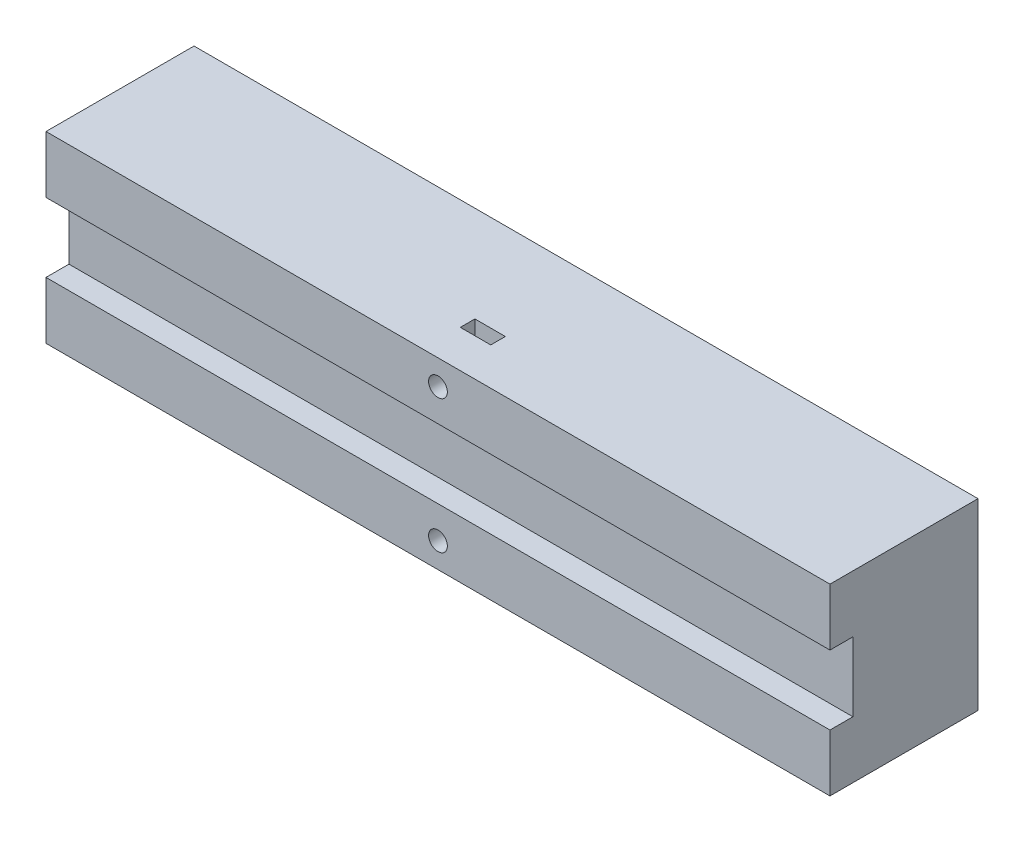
SolidWorks part; units mm, degrees
ref_plane "前视基准面" through (0, 0, 0) normal (0, 0, 1) x (1, 0, 0)
ref_plane "上视基准面" through (0, 0, 0) normal (0, 1, 0) x (1, 0, 0)
ref_plane "右视基准面" through (0, 0, 0) normal (1, 0, 0) x (0, 0, -1)
other "Configuration Table"
sketch "草图1" plane through (0, 0, 0) normal (0, 0, 1) x (1, 0, 0)
  line L0 (-94, -22) -> (94, -22)
  line L1 (94, -22) -> (94, 22)
  line L2 (94, 22) -> (-94, 22)
  line L3 (-94, 22) -> (-94, -22)
  circle A0 centre (0, -16) radius 2.25
  circle A1 centre (0, 16) radius 2.25
  dimension "D1" = 4.5
  dimension "D2" = 94
  dimension "D3" = 94
  dimension "D4" = 16
  dimension "D5" = 22
  dimension "D6" = 16
  dimension "D7" = 22
extrude "Riser_band_1" add sketch "草图1" along normal blind 23
sketch "草图2" plane through (0, 0, 0) normal (0, 0, 1) x (1, 0, 0)
  line L0 (-94, -22) -> (-3.65, -22)
  line L1 (-3.65, -22) -> (-3.65, -11.75)
  line L2 (-3.65, -11.75) -> (3.65, -11.75)
  line L3 (3.65, -11.75) -> (3.65, -22)
  line L4 (3.65, -22) -> (94, -22)
  line L5 (94, -22) -> (94, 22)
  line L6 (94, 22) -> (3.65, 22)
  line L7 (3.65, 22) -> (3.65, 11.75)
  line L8 (3.65, 11.75) -> (-3.65, 11.75)
  line L9 (-3.65, 11.75) -> (-3.65, 22)
  line L10 (-3.65, 22) -> (-94, 22)
  line L11 (-94, 22) -> (-94, -22)
  dimension "D1" = 3.65
  dimension "D2" = 94
  dimension "D3" = 3.65
  dimension "D4" = 11.75
  dimension "D5" = 22
  dimension "D6" = 11.75
extrude "Riser_band_2" add sketch "草图2" along normal blind 3.5 from offset 23
sketch "草图3" plane through (0, 0, 0) normal (0, 0, 1) x (1, 0, 0)
  line L0 (-94, -22) -> (94, -22)
  line L1 (94, -22) -> (94, 22)
  line L2 (94, 22) -> (-94, 22)
  line L3 (-94, 22) -> (-94, -22)
  circle A0 centre (0, -16) radius 2.25
  circle A1 centre (0, 16) radius 2.25
  dimension "D1" = 4.5
  dimension "D2" = 94
  dimension "D3" = 94
  dimension "D4" = 16
  dimension "D5" = 22
  dimension "D6" = 16
  dimension "D7" = 22
extrude "Riser_band_3" add sketch "草图3" along normal blind 3.5 from offset 26.5
sketch "草图4" plane through (0, 0, 0) normal (0, 0, 1) x (1, 0, 0)
  line L0 (-94, -22) -> (94, -22)
  line L1 (94, -22) -> (94, -8.3)
  line L2 (94, -8.3) -> (-94, -8.3)
  line L3 (-94, -8.3) -> (-94, -22)
  line L4 (-94, 8.3) -> (94, 8.3)
  line L5 (94, 8.3) -> (94, 22)
  line L6 (94, 22) -> (-94, 22)
  line L7 (-94, 22) -> (-94, 8.3)
  circle A0 centre (0, -16) radius 2.25
  circle A1 centre (0, 16) radius 2.25
  dimension "D1" = 4.5
  dimension "D2" = 94
  dimension "D3" = 94
  dimension "D4" = 8.3
  dimension "D5" = 16
  dimension "D6" = 22
  dimension "D7" = 8.3
  dimension "D8" = 16
extrude "Side_retention_lips_below_old_rail_top" add sketch "草图4" along normal blind 5.5 from offset 30
